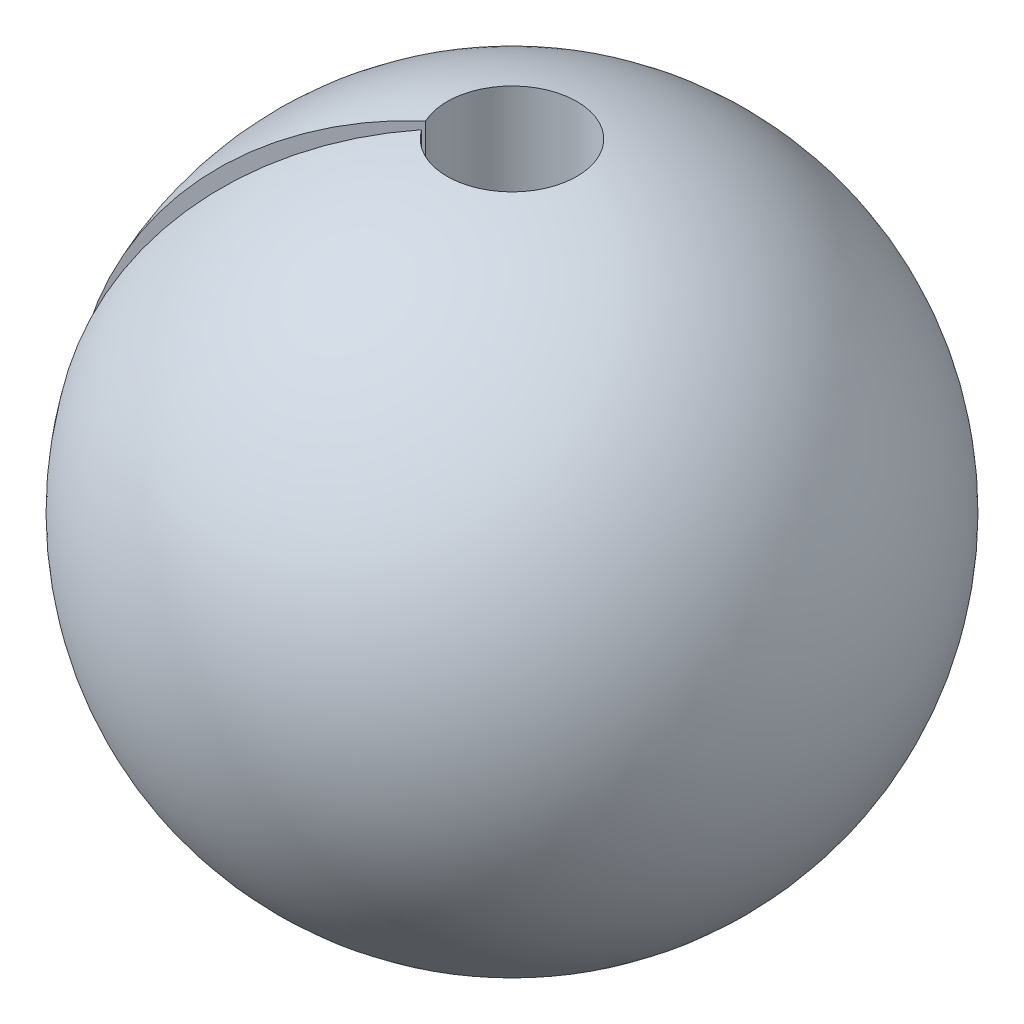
SolidWorks part; units mm, degrees
ref_plane "前视基准面" through (0, 0, 0) normal (0, 0, 1) x (1, 0, 0)
ref_plane "上视基准面" through (0, 0, 0) normal (0, 1, 0) x (1, 0, 0)
ref_plane "右视基准面" through (0, 0, 0) normal (1, 0, 0) x (0, 0, -1)
sketch "草图1" plane through (0, 0, 0) normal (0, 0, 1) x (1, 0, 0)
  line L0 (0, 0) -> (0, 50000) construction
  line L1 (65.6742, 215) -> (50065.6742, 215) construction
  line L2 (-69.8734, 0) -> (-50069.8734, 0) construction
  line L3 (-368, 215) -> (-368, 50215) construction
  line L4 (-368, 2046.3929) -> (-368, -1616.3929)
  arc A1 (-368, 2046.3929) -> (-368, -1616.3929) centre (0, 215) ccw
  point P5 (0, 215)
  dimension "D2" = 3736
revolve "旋转1" add sketch "草图1" angle 360 about L0
sketch "草图3" plane through (0, 0, 0) normal (0, 1, 0) x (1, 0, 0)
  line L0 (0, 0) -> (-25000, 43301.2702) construction
  line L1 (0, 0) -> (43301.2702, 25000) construction
  line L2 (-1974.324, -920.6424) -> (0, 0)
  line L3 (0, 0) -> (-1833.547, -1283.8634)
  line L4 (-1833.547, -1283.8634) -> (-1974.324, -920.6424)
  dimension "D1" = 10
  dimension "D2" = 5
extrude "切除-拉伸1" cut sketch "草图3" against normal mid plane 8850
